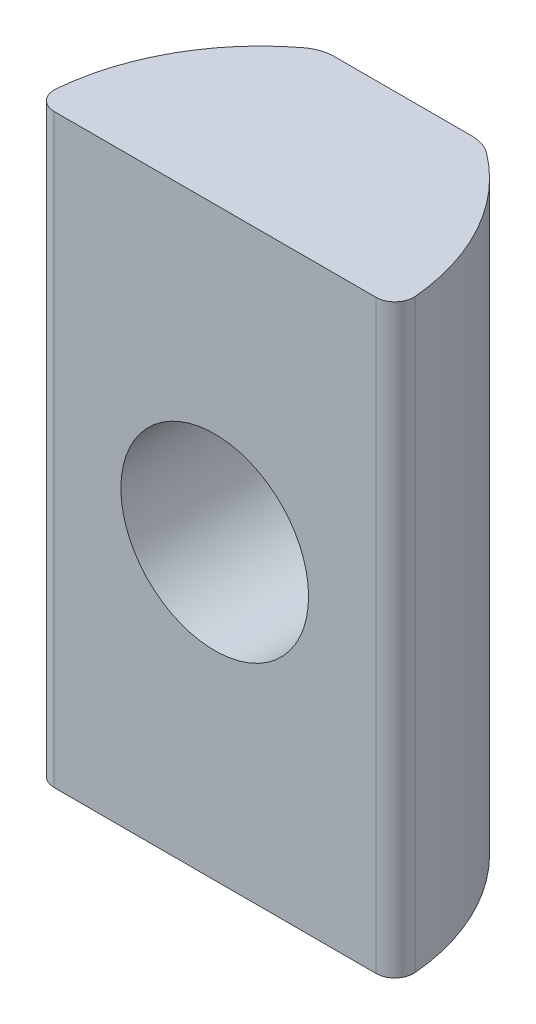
SolidWorks part; units mm, degrees
ref_plane "正面" through (0, 0, 0) normal (0, 0, 1) x (1, 0, 0)
ref_plane "平面" through (0, 0, 0) normal (0, 1, 0) x (1, 0, 0)
ref_plane "右側面" through (0, 0, 0) normal (1, 0, 0) x (0, 0, -1)
sketch "ｽｹｯﾁ1" plane through (0, 0, 0) normal (0, -1, 0) x (1, 0, 0)
  line L8 (-4.2884, 0) -> (4.2884, 0)
  line L9 (1.8306, -5) -> (-1.8306, -5)
  arc A8 (-4.7865, -0.544) -> (-2.4348, -4.7969) centre (1.1902, -0.0157) ccw
  arc A9 (-2.4348, -4.7969) -> (-1.8306, -5) centre (-1.8306, -4) ccw
  arc A10 (-4.2884, 0) -> (-4.7865, -0.544) centre (-4.2884, -0.5) ccw
  arc A11 (2.4348, -4.7969) -> (4.7865, -0.544) centre (-1.1902, -0.0157) ccw
  arc A12 (1.8306, -5) -> (2.4348, -4.7969) centre (1.8306, -4) ccw
  arc A13 (4.7865, -0.544) -> (4.2884, 0) centre (4.2884, -0.5) ccw
extrude "押し出し1" add sketch "ｽｹｯﾁ1" along normal mid plane 15.6
hole_wizard "M6x1.0 ねじ穴1" positions "ｽｹｯﾁ3" profile "ｽｹｯﾁ2" tap size "M6x1.0" standard "JIS"
sketch "ｽｹｯﾁ3" plane through (1.3374, 5.2145, 0) normal (0, 0, 1) x (1, 0, 0)
  line L1 (2.951, -13.0145) -> (-5.6258, -13.0145) construction
  line L3 (2.951, -13.0145) -> (2.951, 2.5855) construction
  point P0 (-1.349, -5.2145)
  dimension "D1" = 7.8
  dimension "D2" = 4.3
sketch "ｽｹｯﾁ2" plane through (-0.0116, 0, 0) normal (1, 0, 0) x (0, -1, 0)
  line L0 (0, 0) -> (0, 5)
  line L1 (0, 5) -> (2.5, 5)
  line L2 (2.5, 5) -> (2.5, 0)
  line L5 (2.5, 0) -> (0, 0)
  line L11 (0, -6.35) -> (0, 107.95) construction
  dimension "通孔螺纹孔钻头直径" = 5
  dimension "通孔螺纹孔钻头深度" = 5
